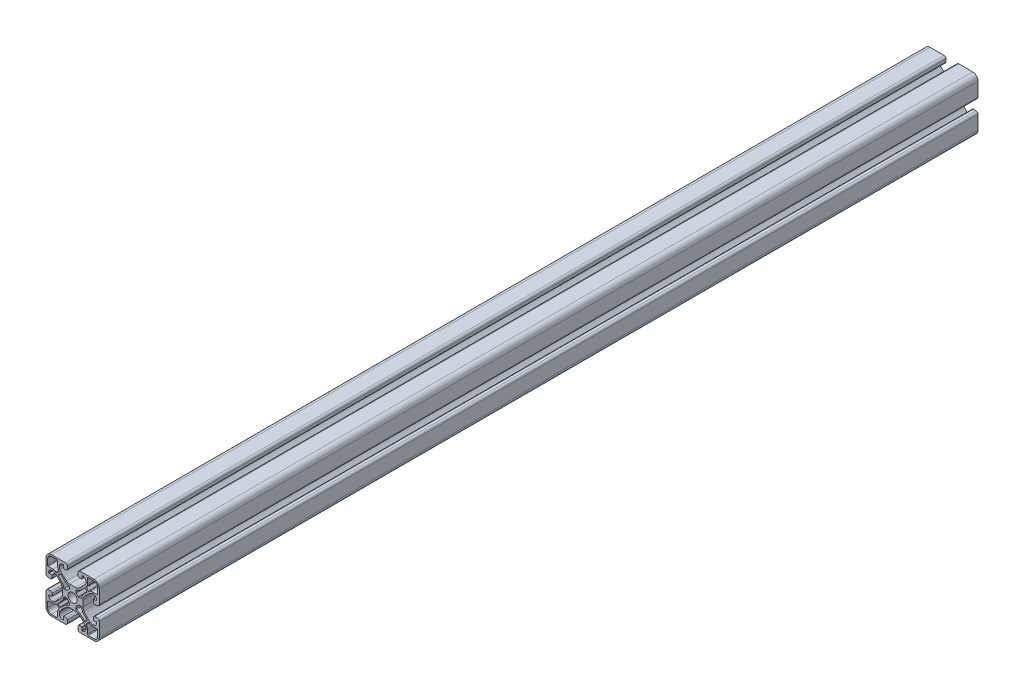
SolidWorks part; units mm, degrees
ref_plane "Face" through (0, 0, 0) normal (0, 0, 1) x (1, 0, 0)
ref_plane "Dessus" through (0, 0, 0) normal (0, 1, 0) x (1, 0, 0)
ref_plane "Droite" through (0, 0, 0) normal (1, 0, 0) x (0, 0, -1)
sketch "Esquisse profilé" plane through (0, 0, 0) normal (0, 0, 1) x (1, 0, 0)
  line L0 (11.6997, 18.8) -> (16, 18.8)
  line L1 (18.8, 16) -> (18.8, 11.7)
  line L2 (18.3, 11.2) -> (14.67, 11.2)
  line L3 (12.3957, 10.2874) -> (12.7389, 10.5517)
  line L4 (11.7339, 10.3275) -> (10.3272, 11.7342)
  line L5 (10.5513, 12.7393) -> (10.2871, 12.3961)
  line L6 (11.1997, 14.6704) -> (11.1997, 18.3)
  line L7 (-11.1997, 14.6699) -> (-11.1997, 18.3)
  line L8 (-10.5517, 12.7393) -> (-10.2874, 12.3961)
  line L9 (-11.7342, 10.3275) -> (-10.3275, 11.7342)
  line L10 (-12.3961, 10.2874) -> (-12.7393, 10.5517)
  line L11 (-18.3, 11.2) -> (-14.6704, 11.2)
  line L12 (-18.8, 16) -> (-18.8, 11.7)
  line L13 (-11.6997, 18.8) -> (-16, 18.8)
  line L14 (-2.5, 6.0982) -> (-2.5, 4.6098)
  line L15 (-4.6098, 2.5) -> (-6.0982, 2.5)
  line L16 (-10.7615, 9.6032) -> (-9.6032, 10.7615)
  line L17 (-10.7615, -9.6032) -> (-9.6032, -10.7615)
  line L18 (-4.6098, -2.5) -> (-6.0982, -2.5)
  line L19 (-2.5, -6.0982) -> (-2.5, -4.6098)
  line L20 (-11.7, -18.8) -> (-16, -18.8)
  line L21 (-18.8, -16) -> (-18.8, -11.7)
  line L22 (-18.3, -11.2) -> (-14.6704, -11.2)
  line L23 (-12.3961, -10.2874) -> (-12.7393, -10.5517)
  line L24 (-11.7342, -10.3275) -> (-10.3275, -11.7342)
  line L25 (-10.5517, -12.7393) -> (-10.2874, -12.3961)
  line L26 (-11.2, -14.6704) -> (-11.2, -18.3)
  line L27 (9.6032, 10.7615) -> (10.7615, 9.6032)
  line L28 (6.0982, 2.5) -> (4.6098, 2.5)
  line L29 (2.5, 4.6098) -> (2.5, 6.0982)
  line L30 (2.5, -4.6098) -> (2.5, -6.0982)
  line L31 (6.0982, -2.5) -> (4.6098, -2.5)
  line L32 (9.6032, -10.7615) -> (10.7615, -9.6032)
  line L33 (11.1997, -14.6704) -> (11.1997, -18.3)
  line L34 (10.5513, -12.7393) -> (10.2871, -12.3961)
  line L35 (11.7339, -10.3275) -> (10.3272, -11.7342)
  line L36 (12.3957, -10.2874) -> (12.7389, -10.5517)
  line L37 (18.3, -11.2) -> (14.67, -11.2)
  line L38 (18.8, -16) -> (18.8, -11.7)
  line L39 (11.6997, -18.8) -> (16, -18.8)
  line L40 (5.5, -20) -> (16, -20)
  line L41 (4, -16.5) -> (4, -18.5)
  line L42 (6.75, -15.5) -> (5, -15.5)
  line L43 (7, -17.75) -> (7, -15.75)
  line L44 (7.5, -18) -> (7.25, -18)
  line L45 (10, -14.7204) -> (10, -15.5)
  line L46 (-2.1931, -7.75) -> (2.1931, -7.75)
  line L47 (-10, -15.5) -> (-10, -14.7204)
  line L48 (-7.25, -18) -> (-7.5, -18)
  line L49 (-7, -15.75) -> (-7, -17.75)
  line L50 (-5, -15.5) -> (-6.75, -15.5)
  line L51 (-4, -18.5) -> (-4, -16.5)
  line L52 (-16, -20) -> (-5.5, -20)
  line L53 (-20, -5.5) -> (-20, -16)
  line L54 (-16.5, -4) -> (-18.5, -4)
  line L55 (-15.5, -6.75) -> (-15.5, -5)
  line L56 (-17.75, -7) -> (-15.75, -7)
  line L57 (-18, -7.5) -> (-18, -7.25)
  line L58 (-14.7204, -10) -> (-15.5, -10)
  line L59 (-7.75, 2.1931) -> (-7.75, -2.1931)
  line L60 (-15.5, 10) -> (-14.7204, 10)
  line L61 (-18, 7.25) -> (-18, 7.5)
  line L62 (-15.75, 7) -> (-17.75, 7)
  line L63 (-15.5, 5) -> (-15.5, 6.75)
  line L64 (-18.5, 4) -> (-16.5, 4)
  line L65 (-20, 16) -> (-20, 5.5)
  line L66 (-5.5, 20) -> (-16, 20)
  line L67 (-4, 16.5) -> (-4, 18.5)
  line L68 (-6.75, 15.5) -> (-5, 15.5)
  line L69 (-7, 17.75) -> (-7, 15.75)
  line L70 (-7.5, 18) -> (-7.25, 18)
  line L71 (-10, 14.7204) -> (-10, 15.5)
  line L72 (2.1931, 7.75) -> (-2.1931, 7.75)
  line L73 (10, 15.5) -> (10, 14.7204)
  line L74 (7.25, 18) -> (7.5, 18)
  line L75 (7, 15.75) -> (7, 17.75)
  line L76 (5, 15.5) -> (6.75, 15.5)
  line L77 (4, 18.5) -> (4, 16.5)
  line L78 (16, 20) -> (5.5, 20)
  line L79 (20, 5.5) -> (20, 16)
  line L80 (16.5, 4) -> (18.5, 4)
  line L81 (15.5, 6.75) -> (15.5, 5)
  line L82 (17.75, 7) -> (15.75, 7)
  line L83 (18, 7.5) -> (18, 7.25)
  line L84 (14.7204, 10) -> (15.5, 10)
  line L85 (7.75, -2.1931) -> (7.75, 2.1931)
  line L86 (15.5, -10) -> (14.7204, -10)
  line L87 (18, -7.25) -> (18, -7.5)
  line L88 (15.75, -7) -> (17.75, -7)
  line L89 (15.5, -5) -> (15.5, -6.75)
  line L90 (18.5, -4) -> (16.5, -4)
  line L91 (20, -16) -> (20, -5.5)
  arc A0 (11.1997, 18.3) -> (11.6997, 18.8) centre (11.6997, 18.3) cw
  arc A1 (-11.1997, 14.6699) -> (-10.5517, 12.7393) centre (-7.9997, 14.6699) ccw
  arc A2 (16, 18.8) -> (18.8, 16) centre (16, 16) cw
  arc A3 (18.8, 11.7) -> (18.3, 11.2) centre (18.3, 11.7) cw
  arc A4 (12.7389, 10.5517) -> (14.67, 11.2) centre (14.67, 8) cw
  arc A5 (12.3957, 10.2874) -> (11.7339, 10.3275) centre (12.0874, 10.6811) cw
  arc A6 (10.3272, 11.7342) -> (10.2871, 12.3961) centre (10.6807, 12.0878) cw
  arc A7 (11.1997, 14.6704) -> (10.5513, 12.7393) centre (7.9997, 14.6704) cw
  arc A8 (-10.3275, 11.7342) -> (-10.2874, 12.3961) centre (-10.6811, 12.0878) ccw
  arc A9 (-12.3961, 10.2874) -> (-11.7342, 10.3275) centre (-12.0878, 10.6811) ccw
  arc A10 (-12.7393, 10.5517) -> (-14.6704, 11.2) centre (-14.6704, 8) ccw
  arc A11 (-18.8, 11.7) -> (-18.3, 11.2) centre (-18.3, 11.7) ccw
  arc A12 (-16, 18.8) -> (-18.8, 16) centre (-16, 16) ccw
  arc A13 (-11.1997, 18.3) -> (-11.6997, 18.8) centre (-11.6997, 18.3) ccw
  arc A14 (-8.8828, 10.7477) -> (-5.38, 7.59) centre (10.34, 28.55) ccw
  arc A15 (-5.38, 7.59) -> (-2.9351, 6.594) centre (-2.26, 11.75) ccw
  arc A16 (-2.5, 6.0982) -> (-2.9351, 6.594) centre (-3, 6.0982) ccw
  arc A17 (-2.7273, 4.1907) -> (-2.5, 4.6098) centre (-3, 4.6098) ccw
  arc A18 (-2.7273, 4.1907) -> (-4.1907, 2.7273) centre (0, 0) ccw
  arc A19 (-4.6098, 2.5) -> (-4.1907, 2.7273) centre (-4.6098, 3) ccw
  arc A20 (-6.594, 2.9351) -> (-6.0982, 2.5) centre (-6.0982, 3) ccw
  arc A21 (-6.594, 2.9351) -> (-7.59, 5.38) centre (-11.75, 2.26) ccw
  arc A22 (-7.59, 5.38) -> (-10.7477, 8.8828) centre (-28.55, -10.34) ccw
  arc A23 (-10.7615, 9.6032) -> (-10.7477, 8.8828) centre (-10.4079, 9.2497) ccw
  arc A24 (-8.8828, 10.7477) -> (-9.6032, 10.7615) centre (-9.2497, 10.4079) ccw
  arc A25 (-8.8828, -10.7477) -> (-9.6032, -10.7615) centre (-9.2497, -10.4079) cw
  arc A26 (-10.7615, -9.6032) -> (-10.7477, -8.8828) centre (-10.4079, -9.2497) cw
  arc A27 (-7.59, -5.38) -> (-10.7477, -8.8828) centre (-28.55, 10.34) cw
  arc A28 (-6.594, -2.9351) -> (-7.59, -5.38) centre (-11.75, -2.26) cw
  arc A29 (-6.594, -2.9351) -> (-6.0982, -2.5) centre (-6.0982, -3) cw
  arc A30 (-4.6098, -2.5) -> (-4.1907, -2.7273) centre (-4.6098, -3) cw
  arc A31 (-2.7273, -4.1907) -> (-4.1907, -2.7273) centre (0, 0) cw
  arc A32 (-2.7273, -4.1907) -> (-2.5, -4.6098) centre (-3, -4.6098) cw
  arc A33 (-2.5, -6.0982) -> (-2.9351, -6.594) centre (-3, -6.0982) cw
  arc A34 (-5.38, -7.59) -> (-2.9351, -6.594) centre (-2.26, -11.75) cw
  arc A35 (-8.8828, -10.7477) -> (-5.38, -7.59) centre (10.34, -28.55) cw
  arc A36 (-11.2, -18.3) -> (-11.7, -18.8) centre (-11.7, -18.3) cw
  arc A37 (-16, -18.8) -> (-18.8, -16) centre (-16, -16) cw
  arc A38 (-18.8, -11.7) -> (-18.3, -11.2) centre (-18.3, -11.7) cw
  arc A39 (-12.7393, -10.5517) -> (-14.6704, -11.2) centre (-14.6704, -8) cw
  arc A40 (-12.3961, -10.2874) -> (-11.7342, -10.3275) centre (-12.0878, -10.6811) cw
  arc A41 (-10.3275, -11.7342) -> (-10.2874, -12.3961) centre (-10.6811, -12.0878) cw
  arc A42 (-11.2, -14.6704) -> (-10.5517, -12.7393) centre (-8, -14.6704) cw
  arc A43 (10.7477, 8.8828) -> (10.7615, 9.6032) centre (10.4079, 9.2497) ccw
  arc A44 (10.7477, 8.8828) -> (7.59, 5.38) centre (28.55, -10.34) ccw
  arc A45 (7.59, 5.38) -> (6.594, 2.9351) centre (11.75, 2.26) ccw
  arc A46 (6.0982, 2.5) -> (6.594, 2.9351) centre (6.0982, 3) ccw
  arc A47 (4.1907, 2.7273) -> (4.6098, 2.5) centre (4.6098, 3) ccw
  arc A48 (4.1907, 2.7273) -> (2.7273, 4.1907) centre (0, 0) ccw
  arc A49 (2.5, 4.6098) -> (2.7273, 4.1907) centre (3, 4.6098) ccw
  arc A50 (2.9351, 6.594) -> (2.5, 6.0982) centre (3, 6.0982) ccw
  arc A51 (2.9351, 6.594) -> (5.38, 7.59) centre (2.26, 11.75) ccw
  arc A52 (5.38, 7.59) -> (8.8828, 10.7477) centre (-10.34, 28.55) ccw
  arc A53 (9.6032, 10.7615) -> (8.8828, 10.7477) centre (9.2497, 10.4079) ccw
  arc A54 (9.6032, -10.7615) -> (8.8828, -10.7477) centre (9.2497, -10.4079) cw
  arc A55 (5.38, -7.59) -> (8.8828, -10.7477) centre (-10.34, -28.55) cw
  arc A56 (2.9351, -6.594) -> (5.38, -7.59) centre (2.26, -11.75) cw
  arc A57 (2.9351, -6.594) -> (2.5, -6.0982) centre (3, -6.0982) cw
  arc A58 (2.5, -4.6098) -> (2.7273, -4.1907) centre (3, -4.6098) cw
  arc A59 (4.1907, -2.7273) -> (2.7273, -4.1907) centre (0, 0) cw
  arc A60 (4.1907, -2.7273) -> (4.6098, -2.5) centre (4.6098, -3) cw
  arc A61 (6.0982, -2.5) -> (6.594, -2.9351) centre (6.0982, -3) cw
  arc A62 (7.59, -5.38) -> (6.594, -2.9351) centre (11.75, -2.26) cw
  arc A63 (10.7477, -8.8828) -> (7.59, -5.38) centre (28.55, 10.34) cw
  arc A64 (10.7477, -8.8828) -> (10.7615, -9.6032) centre (10.4079, -9.2497) cw
  arc A65 (11.1997, -14.6704) -> (10.5513, -12.7393) centre (7.9997, -14.6704) ccw
  arc A66 (10.3272, -11.7342) -> (10.2871, -12.3961) centre (10.6807, -12.0878) ccw
  arc A67 (12.3957, -10.2874) -> (11.7339, -10.3275) centre (12.0874, -10.6811) ccw
  arc A68 (12.7389, -10.5517) -> (14.67, -11.2) centre (14.67, -8) ccw
  arc A69 (18.8, -11.7) -> (18.3, -11.2) centre (18.3, -11.7) ccw
  arc A70 (16, -18.8) -> (18.8, -16) centre (16, -16) ccw
  arc A71 (11.1997, -18.3) -> (11.6997, -18.8) centre (11.6997, -18.3) ccw
  circle A72 centre (0, 0) radius 3.4
  arc A73 (16, -20) -> (20, -16) centre (16, -16) ccw
  arc A74 (4, -18.5) -> (5.5, -20) centre (5.5, -18.5) ccw
  arc A75 (5, -15.5) -> (4, -16.5) centre (5, -16.5) ccw
  arc A76 (7, -15.75) -> (6.75, -15.5) centre (6.75, -15.75) ccw
  arc A77 (7, -17.75) -> (7.25, -18) centre (7.25, -17.75) ccw
  arc A78 (7.5, -18) -> (10, -15.5) centre (7.5, -15.5) ccw
  arc A79 (10, -14.7204) -> (9.5948, -13.5134) centre (8, -14.7204) ccw
  arc A80 (9.5948, -13.5134) -> (4.5803, -8.5405) centre (-10.34, -28.6) ccw
  arc A81 (4.5803, -8.5405) -> (2.1931, -7.75) centre (2.1931, -11.75) ccw
  arc A82 (-2.1931, -7.75) -> (-4.5803, -8.5405) centre (-2.1931, -11.75) ccw
  arc A83 (-4.5803, -8.5405) -> (-9.5948, -13.5134) centre (10.34, -28.6) ccw
  arc A84 (-9.5948, -13.5134) -> (-10, -14.7204) centre (-8, -14.7204) ccw
  arc A85 (-10, -15.5) -> (-7.5, -18) centre (-7.5, -15.5) ccw
  arc A86 (-7.25, -18) -> (-7, -17.75) centre (-7.25, -17.75) ccw
  arc A87 (-6.75, -15.5) -> (-7, -15.75) centre (-6.75, -15.75) ccw
  arc A88 (-4, -16.5) -> (-5, -15.5) centre (-5, -16.5) ccw
  arc A89 (-5.5, -20) -> (-4, -18.5) centre (-5.5, -18.5) ccw
  arc A90 (-20, -16) -> (-16, -20) centre (-16, -16) ccw
  arc A91 (-18.5, -4) -> (-20, -5.5) centre (-18.5, -5.5) ccw
  arc A92 (-15.5, -5) -> (-16.5, -4) centre (-16.5, -5) ccw
  arc A93 (-15.75, -7) -> (-15.5, -6.75) centre (-15.75, -6.75) ccw
  arc A94 (-17.75, -7) -> (-18, -7.25) centre (-17.75, -7.25) ccw
  arc A95 (-18, -7.5) -> (-15.5, -10) centre (-15.5, -7.5) ccw
  arc A96 (-14.7204, -10) -> (-13.5134, -9.5948) centre (-14.7204, -8) ccw
  arc A97 (-13.5134, -9.5948) -> (-8.5405, -4.5803) centre (-28.6, 10.34) ccw
  arc A98 (-8.5405, -4.5803) -> (-7.75, -2.1931) centre (-11.75, -2.1931) ccw
  arc A99 (-7.75, 2.1931) -> (-8.5405, 4.5803) centre (-11.75, 2.1931) ccw
  arc A100 (-8.5405, 4.5803) -> (-13.5134, 9.5948) centre (-28.6, -10.34) ccw
  arc A101 (-13.5134, 9.5948) -> (-14.7204, 10) centre (-14.7204, 8) ccw
  arc A102 (-15.5, 10) -> (-18, 7.5) centre (-15.5, 7.5) ccw
  arc A103 (-18, 7.25) -> (-17.75, 7) centre (-17.75, 7.25) ccw
  arc A104 (-15.5, 6.75) -> (-15.75, 7) centre (-15.75, 6.75) ccw
  arc A105 (-16.5, 4) -> (-15.5, 5) centre (-16.5, 5) ccw
  arc A106 (-20, 5.5) -> (-18.5, 4) centre (-18.5, 5.5) ccw
  arc A107 (-16, 20) -> (-20, 16) centre (-16, 16) ccw
  arc A108 (-4, 18.5) -> (-5.5, 20) centre (-5.5, 18.5) ccw
  arc A109 (-5, 15.5) -> (-4, 16.5) centre (-5, 16.5) ccw
  arc A110 (-7, 15.75) -> (-6.75, 15.5) centre (-6.75, 15.75) ccw
  arc A111 (-7, 17.75) -> (-7.25, 18) centre (-7.25, 17.75) ccw
  arc A112 (-7.5, 18) -> (-10, 15.5) centre (-7.5, 15.5) ccw
  arc A113 (-10, 14.7204) -> (-9.5948, 13.5134) centre (-8, 14.7204) ccw
  arc A114 (-9.5948, 13.5134) -> (-4.5803, 8.5405) centre (10.34, 28.6) ccw
  arc A115 (-4.5803, 8.5405) -> (-2.1931, 7.75) centre (-2.1931, 11.75) ccw
  arc A116 (2.1931, 7.75) -> (4.5803, 8.5405) centre (2.1931, 11.75) ccw
  arc A117 (4.5803, 8.5405) -> (9.5948, 13.5134) centre (-10.34, 28.6) ccw
  arc A118 (9.5948, 13.5134) -> (10, 14.7204) centre (8, 14.7204) ccw
  arc A119 (10, 15.5) -> (7.5, 18) centre (7.5, 15.5) ccw
  arc A120 (7.25, 18) -> (7, 17.75) centre (7.25, 17.75) ccw
  arc A121 (6.75, 15.5) -> (7, 15.75) centre (6.75, 15.75) ccw
  arc A122 (4, 16.5) -> (5, 15.5) centre (5, 16.5) ccw
  arc A123 (5.5, 20) -> (4, 18.5) centre (5.5, 18.5) ccw
  arc A124 (20, 16) -> (16, 20) centre (16, 16) ccw
  arc A125 (18.5, 4) -> (20, 5.5) centre (18.5, 5.5) ccw
  arc A126 (15.5, 5) -> (16.5, 4) centre (16.5, 5) ccw
  arc A127 (15.75, 7) -> (15.5, 6.75) centre (15.75, 6.75) ccw
  arc A128 (17.75, 7) -> (18, 7.25) centre (17.75, 7.25) ccw
  arc A129 (18, 7.5) -> (15.5, 10) centre (15.5, 7.5) ccw
  arc A130 (14.7204, 10) -> (13.5134, 9.5948) centre (14.7204, 8) ccw
  arc A131 (13.5134, 9.5948) -> (8.5405, 4.5803) centre (28.6, -10.34) ccw
  arc A132 (8.5405, 4.5803) -> (7.75, 2.1931) centre (11.75, 2.1931) ccw
  arc A133 (7.75, -2.1931) -> (8.5405, -4.5803) centre (11.75, -2.1931) ccw
  arc A134 (8.5405, -4.5803) -> (13.5134, -9.5948) centre (28.6, 10.34) ccw
  arc A135 (13.5134, -9.5948) -> (14.7204, -10) centre (14.7204, -8) ccw
  arc A136 (15.5, -10) -> (18, -7.5) centre (15.5, -7.5) ccw
  arc A137 (18, -7.25) -> (17.75, -7) centre (17.75, -7.25) ccw
  arc A138 (15.5, -6.75) -> (15.75, -7) centre (15.75, -6.75) ccw
  arc A139 (16.5, -4) -> (15.5, -5) centre (16.5, -5) ccw
  arc A140 (20, -5.5) -> (18.5, -4) centre (18.5, -5.5) ccw
extrude "Extrusion1" add sketch "Esquisse profilé" along normal blind 660
